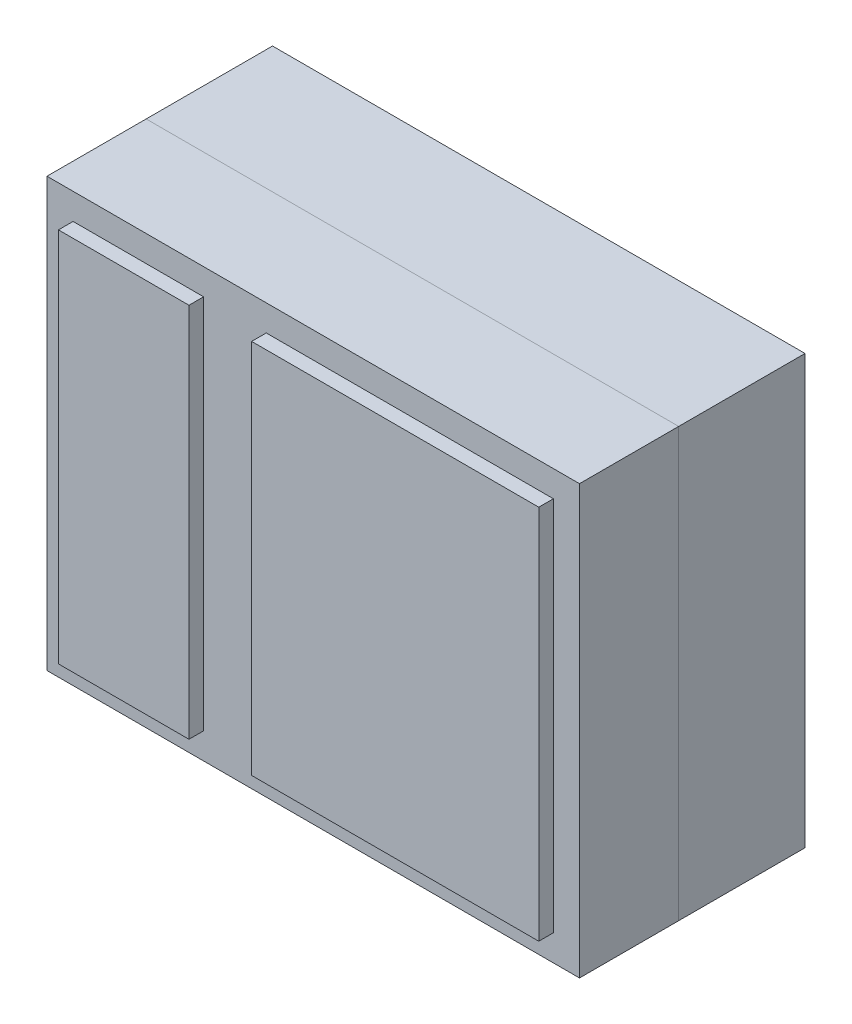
SolidWorks part; units mm, degrees
ref_plane "前视基准面" through (0, 0, 0) normal (0, 0, 1) x (1, 0, 0)
ref_plane "上视基准面" through (0, 0, 0) normal (0, 1, 0) x (1, 0, 0)
ref_plane "右视基准面" through (0, 0, 0) normal (1, 0, 0) x (0, 0, -1)
sketch "草图1" plane through (0, 0, 0) normal (0, 0, 1) x (1, 0, 0)
  line L1 (-0.72, 0.82) -> (1.32, 0.82)
  line L2 (-0.72, 0.82) -> (-0.72, -0.82)
  line L3 (-0.72, -0.82) -> (1.32, -0.82)
  line L4 (1.32, 0.82) -> (1.32, -0.82)
  point P0 (0, 0)
  dimension "D1" = 1.64
  dimension "D2" = 2.04
  dimension "D3" = 0.72
  dimension "D4" = 0.82
extrude "凸台-拉伸1" add sketch "草图1" along normal blind 0.484
sketch "草图3" plane through (0, 0, 0) normal (0, 0, -1) x (-1, 0, 0)
  line L0 (0.62, -0.04) -> (-1.11, -0.04)
  line L1 (-1.11, -0.04) -> (-1.11, -0.62)
  line L2 (-1.11, -0.62) -> (-0.8505, -0.62)
  line L3 (-0.8505, -0.62) -> (-0.8505, -0.72)
  line L4 (-0.8505, -0.72) -> (0.52, -0.72)
  line L5 (0.52, -0.72) -> (0.52, -0.62)
  line L6 (0.52, -0.62) -> (0.62, -0.62)
  line L7 (0.62, -0.62) -> (0.62, -0.04)
  line L8 (0.62, 0.04) -> (-1.11, 0.04)
  line L9 (-1.11, 0.04) -> (-1.11, 0.62)
  line L10 (-1.11, 0.62) -> (-0.86, 0.62)
  line L11 (-0.86, 0.62) -> (-0.86, 0.25)
  line L12 (-0.86, 0.25) -> (-0.78, 0.25)
  line L13 (-0.78, 0.25) -> (-0.78, 0.72)
  line L14 (-0.78, 0.72) -> (0.52, 0.72)
  line L15 (0.52, 0.72) -> (0.52, 0.62)
  line L16 (0.52, 0.62) -> (0.62, 0.62)
  line L17 (0.62, 0.62) -> (0.62, 0.04)
  line L18 (-1.32, 0.82) -> (0.72, 0.82) construction
  line L19 (-1.32, -0.82) -> (-1.32, 0.82) construction
  line L20 (0.72, -0.82) -> (-1.32, -0.82) construction
  line L21 (0.72, 0.82) -> (0.72, -0.82) construction
  point P15 (-0.6189, 0.388)
  point P17 (-0.5839, 0.388)
  dimension "D1" = 0.08
  dimension "D2" = 0.25
  dimension "D3" = 0.08
  dimension "D4" = 0.1
  dimension "D5" = 0.2
  dimension "D6" = 0.57
  dimension "D7" = 0.21
  dimension "D8" = 0.21
  dimension "D9" = 0.2
  dimension "D10" = 0.1
  dimension "D11" = 0.58
  dimension "D12" = 0.1
  dimension "D13" = 0.1
  dimension "D14" = 0.2
  dimension "D15" = 0.2
  dimension "D16" = 0.2
  dimension "D17" = 0.2
extrude "凸台-拉伸2" add sketch "草图3" along normal blind 0.056 from surface at -0.484 separate body
sketch "草图4" plane through (0, 0, 0) normal (0, 0, -1) x (-1, 0, 0)
  line L1 (-0.445, 0.445) -> (0.445, 0.445)
  line L2 (-0.445, 0.445) -> (-0.445, -0.445)
  line L3 (-0.445, -0.445) -> (0.445, -0.445)
  line L4 (0.445, 0.445) -> (0.445, -0.445)
  line L5 (-0.445, 0.445) -> (0.445, -0.445) construction
  line L6 (-0.445, -0.445) -> (0.445, 0.445) construction
  point P0 (0, 0)
  dimension "D1" = 0.89
  dimension "D2" = 0.89
extrude "凸台-拉伸3" add sketch "草图4" along normal blind 0.15 from surface at -0.428 separate body
sketch "草图5" plane through (0, 0, 0.428) normal (0, 0, -1) x (-1, 0, 0)
  line L1 (-0.9327, 0.21) -> (-0.7127, 0.21)
  line L2 (-0.9327, 0.21) -> (-0.9327, -0.21)
  line L3 (-0.9327, -0.21) -> (-0.7127, -0.21)
  line L4 (-0.7127, 0.21) -> (-0.7127, -0.21)
  line L5 (-0.9327, 0.21) -> (-0.7127, -0.21) construction
  line L6 (-0.9327, -0.21) -> (-0.7127, 0.21) construction
  point P0 (-0.8227, 0)
  point P5 (-0.8227, 0)
  point P7 (0, 0)
  point P8 (-0.843, 0)
  dimension "D1" = 0.42
  dimension "D2" = 0.22
extrude "凸台-拉伸4" add sketch "草图5" along normal blind 0.1 separate body
sketch "草图6" plane through (0, 0, 0.484) normal (0, 0, 1) x (1, 0, 0)
  line L0 (1.32, -0.82) -> (1.32, 0.82) construction
  line L1 (-0.12, -0.72) -> (-0.62, -0.72)
  line L2 (-0.12, -0.72) -> (-0.12, 0.72)
  line L3 (-0.12, 0.72) -> (-0.62, 0.72)
  line L4 (-0.62, -0.72) -> (-0.62, 0.72)
  line L5 (-0.12, -0.72) -> (-0.62, 0.72) construction
  line L6 (-0.12, 0.72) -> (-0.62, -0.72) construction
  line L7 (1.22, -0.72) -> (0.12, -0.72)
  line L8 (1.22, -0.72) -> (1.22, 0.72)
  line L9 (1.22, 0.72) -> (0.12, 0.72)
  line L10 (0.12, -0.72) -> (0.12, 0.72)
  line L11 (1.22, -0.72) -> (0.12, 0.72) construction
  line L12 (1.22, 0.72) -> (0.12, -0.72) construction
  line L13 (1.32, 0.82) -> (-0.72, 0.82) construction
  line L14 (-0.72, -0.82) -> (1.32, -0.82) construction
  line L15 (-0.72, 0.82) -> (-0.72, -0.82) construction
  point P0 (-0.37, 0)
  point P5 (0.67, 0)
  point P18 (0, 0)
  point P19 (0, 0)
  dimension "D1" = 1.44
  dimension "D2" = 1.1
  dimension "D3" = 0.5
  dimension "D4" = 1.44
  dimension "D5" = 0.1
  dimension "D6" = 0.1
  dimension "D7" = 0.1
  dimension "D8" = 0.1
sketch "草图7" plane through (0, 0, 0.484) normal (0, 0, 1) x (1, 0, 0)
  line L0 (1.32, 0.82) -> (-0.72, 0.82) construction
  line L1 (1.32, -0.82) -> (1.32, 0.82) construction
  line L2 (-0.72, -0.82) -> (1.32, -0.82) construction
  line L3 (-0.72, 0.82) -> (-0.72, -0.82) construction
  line L4 (1.32, 0.82) -> (-0.72, 0.82)
  line L5 (1.32, -0.82) -> (1.32, 0.82)
  line L6 (-0.72, -0.82) -> (1.32, -0.82)
  line L7 (-0.72, 0.82) -> (-0.72, -0.82)
extrude "凸台-拉伸5" add sketch "草图7" along normal blind 0.38 separate body
extrude "凸台-拉伸6" add sketch "草图6" along normal blind 0.056 from surface at 0.38 separate body
